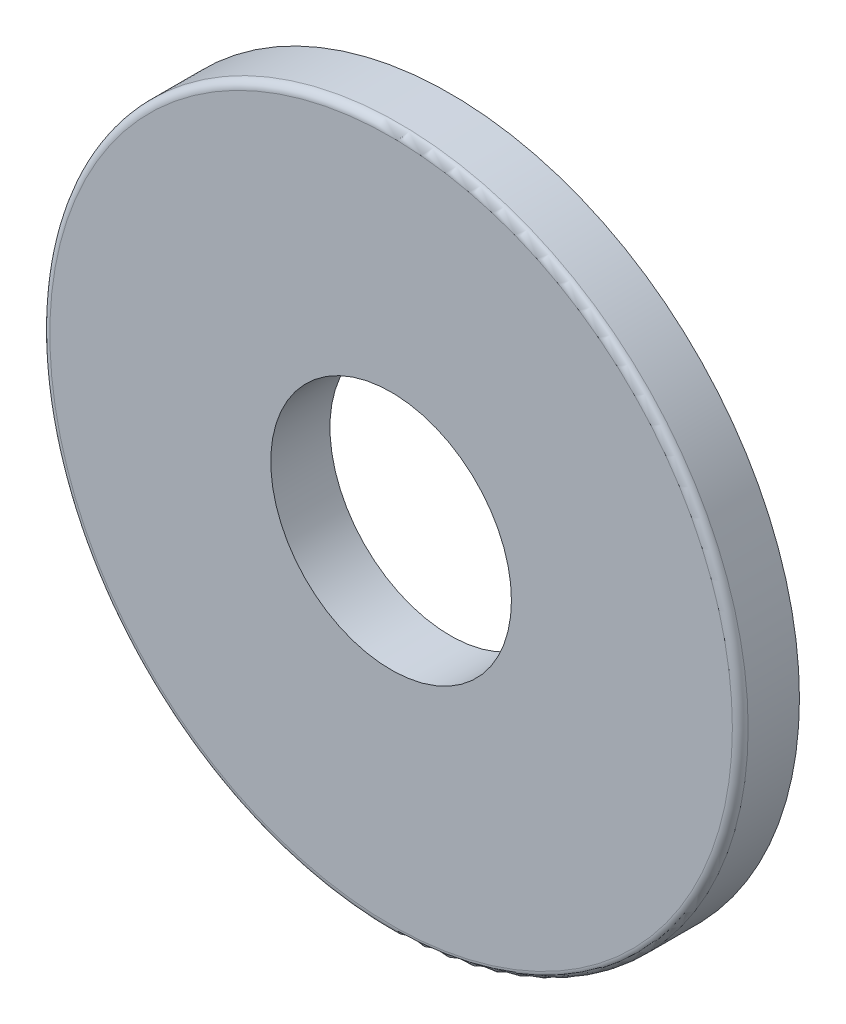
SolidWorks part; units mm, degrees
ref_plane "Face" through (0, 0, 0) normal (0, 0, 1) x (1, 0, 0)
ref_plane "Dessus" through (0, 0, 0) normal (0, 1, 0) x (1, 0, 0)
ref_plane "Droite" through (0, 0, 0) normal (1, 0, 0) x (0, 0, -1)
sketch "Esquisse1" plane through (0, 0, 0) normal (0, 0, 1) x (1, 0, 0)
  circle A0 centre (0, 0) radius 8.85
  circle A1 centre (0, 0) radius 3.05
  dimension "D1" = 17.7
  dimension "D2" = 6.1
extrude "Extrusion1" add sketch "Esquisse1" along normal blind 1.5
fillet "Congé1" radius 0.2
